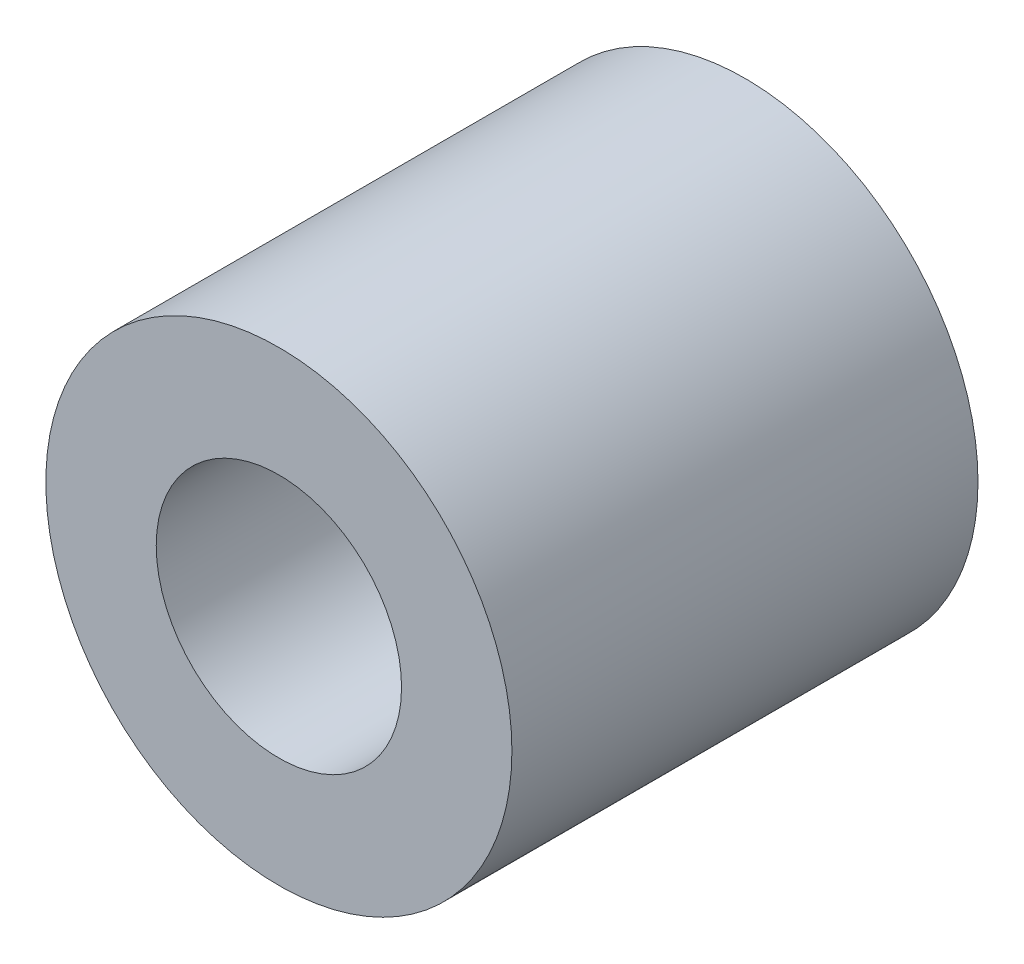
SolidWorks part; units mm, degrees
ref_plane "Front Plane" through (0, 0, 0) normal (0, 0, 1) x (1, 0, 0)
ref_plane "Top Plane" through (0, 0, 0) normal (0, 1, 0) x (1, 0, 0)
ref_plane "Right Plane" through (0, 0, 0) normal (1, 0, 0) x (0, 0, -1)
sketch "Sketch1" plane through (0, 0, 0) normal (0, 0, 1) x (1, 0, 0)
  circle A0 centre (0, 0) radius 4.75
  dimension "D1" = 9.5
extrude "Extrude1" add sketch "Sketch1" against normal blind 9.5
sketch "Sketch2" plane through (0, 0, 0) normal (0, 0, 1) x (1, 0, 0)
  circle A0 centre (0, 0) radius 2.5
  dimension "D1" = 5
extrude "Cut-Extrude1" cut sketch "Sketch2" against normal through all
